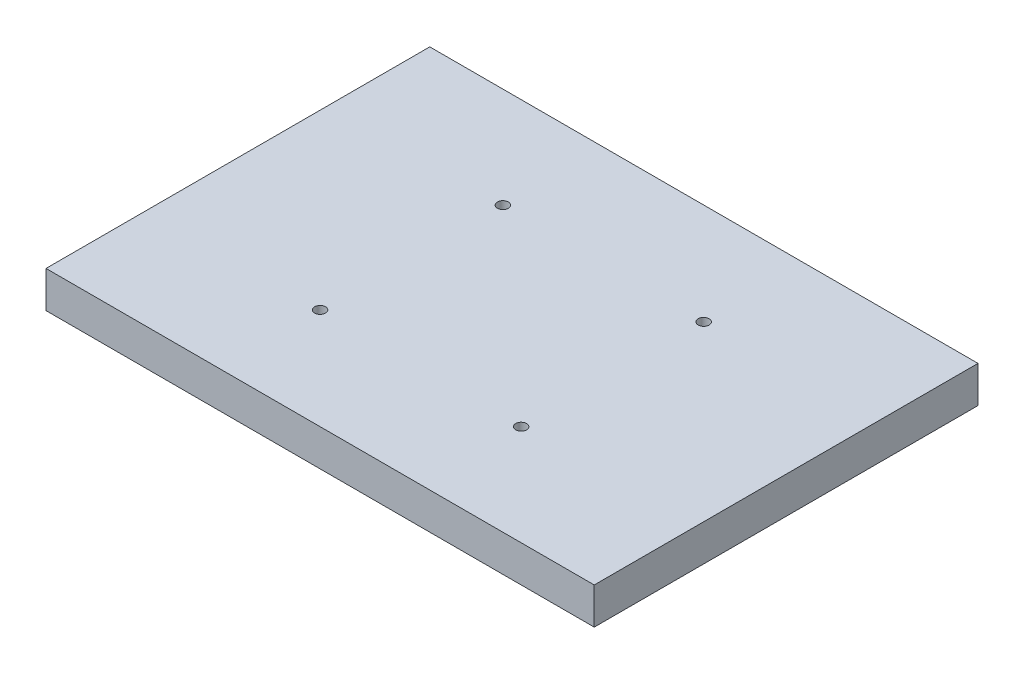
SolidWorks part; units mm, degrees
ref_plane "Front Plane" through (0, 0, 0) normal (0, 0, 1) x (1, 0, 0)
ref_plane "Top Plane" through (0, 0, 0) normal (0, 1, 0) x (1, 0, 0)
ref_plane "Right Plane" through (0, 0, 0) normal (1, 0, 0) x (0, 0, -1)
sketch "Sketch1" plane through (0, 0, 0) normal (0, 1, 0) x (1, 0, 0)
  line L1 (-150, 105) -> (150, 105)
  line L2 (-150, 105) -> (-150, -105)
  line L3 (-150, -105) -> (150, -105)
  line L4 (150, 105) -> (150, -105)
  circle A0 centre (-55.351, -49.6852) radius 3
  circle A1 centre (55, -50) radius 3
  circle A2 centre (-55, 50) radius 3
  circle A4 centre (55.2767, 49.6184) radius 3
  point P0 (0, 0)
  point P8 (0, 0)
  point P13 (0, 0)
  point P14 (0, 0)
  point P17 (0, 0)
  point P18 (0, 0)
  point P19 (0, 0)
  point P20 (0, 0)
extrude "Boss-Extrude1" add sketch "Sketch1" against normal blind 20
